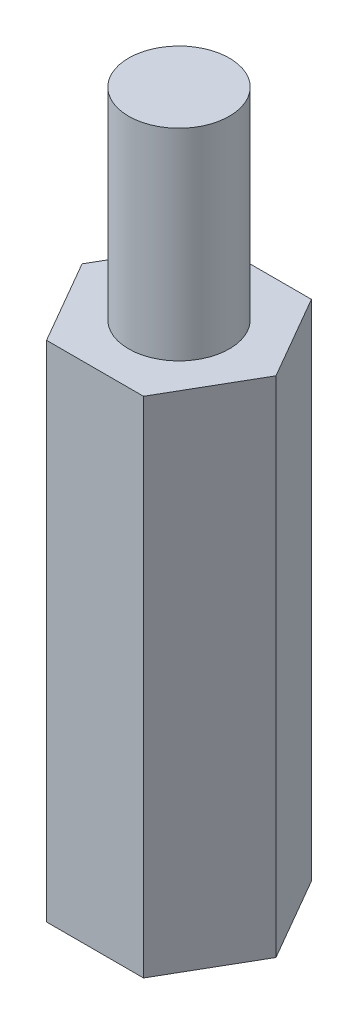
SolidWorks part; units mm, degrees
ref_plane "前视基准面" through (0, 0, 0) normal (0, 0, 1) x (1, 0, 0)
ref_plane "上视基准面" through (0, 0, 0) normal (0, 1, 0) x (1, 0, 0)
ref_plane "右视基准面" through (0, 0, 0) normal (1, 0, 0) x (0, 0, -1)
sketch "草图1" plane through (0, 0, 0) normal (0, 1, 0) x (1, 0, 0)
  line L1 (2.8868, 0) -> (1.4434, 2.5)
  line L2 (1.4434, 2.5) -> (-1.4434, 2.5)
  line L3 (-1.4434, 2.5) -> (-2.8868, 0)
  line L4 (-2.8868, 0) -> (-1.4434, -2.5)
  line L5 (-1.4434, -2.5) -> (1.4434, -2.5)
  line L6 (1.4434, -2.5) -> (2.8868, 0)
  circle A0 centre (0, 0) radius 2.5 construction
  circle A1 centre (0, 0) radius 1.5
  dimension "D1" = 3
  dimension "D2" = 5
extrude "凸台-拉伸1" add sketch "草图1" along normal blind 15
sketch "草图2" plane through (0, 15, 0) normal (0, 1, 0) x (1, 0, 0)
  circle A0 centre (0, 0) radius 1.5 construction
  circle A1 centre (0, 0) radius 1.5
extrude "凸台-拉伸2" add sketch "草图2" along normal blind 6 separate body
